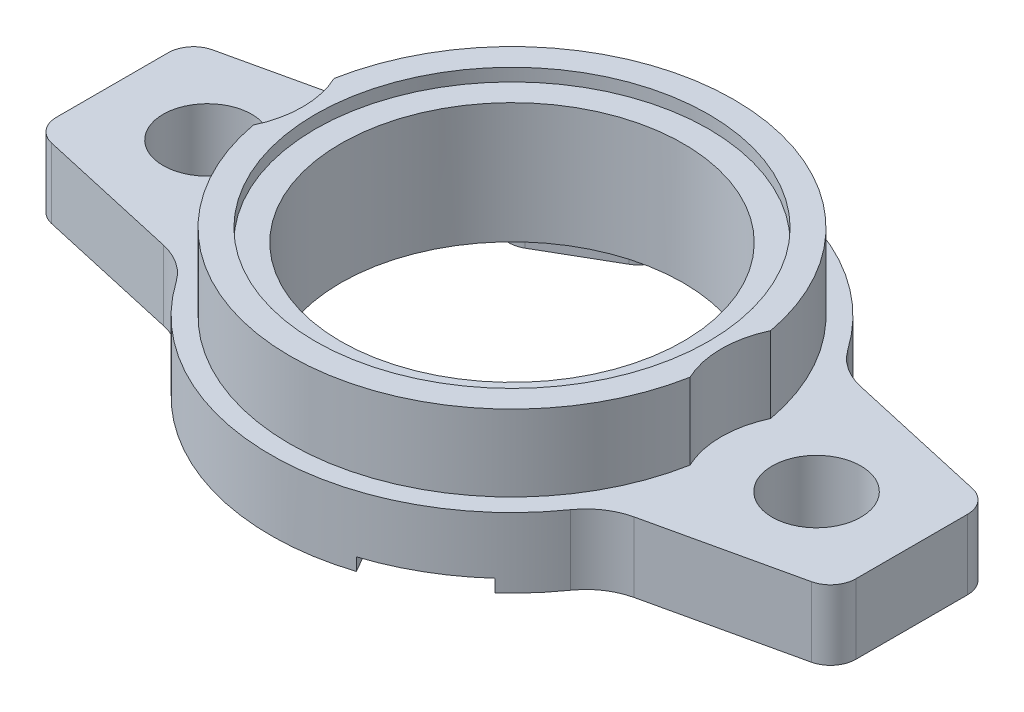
SolidWorks part; units mm, degrees
ref_plane "Спереди" through (0, 0, 0) normal (0, 0, 1) x (1, 0, 0)
ref_plane "Сверху" through (0, 0, 0) normal (0, 1, 0) x (1, 0, 0)
ref_plane "Справа" through (0, 0, 0) normal (1, 0, 0) x (0, 0, -1)
sketch "Эскиз1" plane through (0, 0, 0) normal (0, 1, 0) x (1, 0, 0)
  line L0 (-1000, 0) -> (49000, 0) construction
  line L1 (0, -1000) -> (0, 49000) construction
  line L2 (-31.5, 4.4) -> (-31.5, -4.4)
  line L3 (-29.939, 6.3512) -> (-16.5298, 9.3683)
  line L4 (-29.939, -6.3512) -> (-16.5298, -9.3683)
  line L5 (29.939, -6.3512) -> (16.5298, -9.3683)
  line L6 (29.939, 6.3512) -> (16.5298, 9.3683)
  line L7 (31.5, 4.4) -> (31.5, -4.4)
  circle A0 centre (0, 0) radius 19
  circle A1 centre (-24, 0) radius 3.5
  circle A2 centre (-24, 0) radius 7.5 construction
  arc A3 (-31.5, -4.4) -> (-29.939, -6.3512) centre (-29.5, -4.4) ccw
  arc A4 (-31.5, 4.4) -> (-29.939, 6.3512) centre (-29.5, 4.4) cw
  circle A5 centre (24, 0) radius 7.5 construction
  arc A6 (31.5, 4.4) -> (29.939, 6.3512) centre (29.5, 4.4) ccw
  arc A7 (31.5, -4.4) -> (29.939, -6.3512) centre (29.5, -4.4) cw
  circle A8 centre (24, 0) radius 3.5
  point P16 (-31.5, -6)
  point P19 (-31.5, 6)
  dimension "D1" = 38
  dimension "D3" = 7
  dimension "D4" = 15
  dimension "D6" = 2
  dimension "D2" = 48
  dimension "D5" = 12
extrude "Бобышка-Вытянуть1" add sketch "Эскиз1" along normal blind 11.5 contours A4 L2 A3 L4 A0 L3 A1 | A0 | A7 L7 A6 L6 A0 L5 A8
sketch "Эскиз2" plane through (0, 11.5, 0) normal (0, 1, 0) x (1, 0, 0)
  arc A0 (17.2083, 3.1817) -> (-17.2083, 3.1817) centre (0, 0) ccw
  arc A1 (16.5298, 9.3683) -> (-16.5298, 9.3683) centre (0, 0) ccw construction
  circle A2 centre (0, 0) radius 42.1139
  arc A3 (-17.2083, -3.1817) -> (-17.2083, 3.1817) centre (-24, 0) ccw
  arc A4 (17.2083, 3.1817) -> (17.2083, -3.1817) centre (24, 0) ccw
  arc A5 (-17.2083, -3.1817) -> (17.2083, -3.1817) centre (0, 0) ccw
  dimension "D1" = 1.5
extrude "Вырез-Вытянуть1" cut sketch "Эскиз2" against normal blind 6
sketch "Эскиз3" plane through (0, 11.5, 0) normal (0, 1, 0) x (1, 0, 0)
  circle A0 centre (0, 0) radius 15.5
  arc A1 (17.2083, 3.1817) -> (-17.2083, 3.1817) centre (0, 0) ccw construction
  dimension "D1" = 2
extrude "Вырез-Вытянуть3" cut sketch "Эскиз3" against normal blind 1
sketch "Эскиз4" plane through (0, 0, 0) normal (0, -1, 0) x (1, 0, 0)
  line L0 (-20.8486, -5.3216) -> (-15.7182, -6.4759)
  line L1 (-29.939, -6.3512) -> (-16.5298, -9.3683) construction
  line L2 (0, -1000) -> (0, 49000) construction
  line L3 (-1000, 0) -> (49000, 0) construction
  line L4 (-20.8486, 5.3216) -> (-15.7182, 6.4759)
  line L5 (20.8486, 5.3216) -> (15.7182, 6.4759)
  line L6 (20.8486, -5.3216) -> (15.7182, -6.4759)
  line L7 (0, 0) -> (25000, 43301.2702) construction
  line L9 (6.0359, 18.4545) -> (12.9641, 14.4545)
  line L10 (6.0359, 18.4545) -> (4.5359, 15.8564)
  line L11 (4.9019, 14.4904) -> (10.0981, 11.4904)
  line L12 (12.9641, 14.4545) -> (11.4641, 11.8564)
  line L13 (6.0359, 18.4545) -> (10.9641, 10.9904) construction
  line L14 (4.0359, 14.9904) -> (12.9641, 14.4545) construction
  line L15 (4.4019, 13.6244) -> (9.5981, 10.6244)
  line L18 (-0.2068, 0.1194) -> (-43301.477, 25000.1194) construction
  line L19 (5.6699, 19.8205) -> (3.6699, 16.3564) construction
  line L20 (5.6699, 19.8205) -> (14.3301, 14.8205) construction
  line L21 (14.3301, 14.8205) -> (12.3301, 11.3564) construction
  line L22 (-10.9641, -10.9904) -> (-6.0359, -18.4545) construction
  line L23 (-12.9641, -14.4545) -> (-4.0359, -14.9904) construction
  line L25 (-9.5981, -10.6244) -> (-4.4019, -13.6244)
  line L26 (-6.0359, -18.4545) -> (-4.5359, -15.8564)
  line L27 (-10.0981, -11.4904) -> (-4.9019, -14.4904)
  line L28 (-12.9641, -14.4545) -> (-11.4641, -11.8564)
  line L29 (-12.9641, -14.4545) -> (-6.0359, -18.4545)
  arc A0 (-15.7182, -6.4759) -> (-13.2561, -10.6432) centre (0, 0) ccw
  arc A1 (16.5298, 9.3683) -> (-16.5298, 9.3683) centre (0, 0) ccw construction
  arc A2 (-21.242, -3.5558) -> (-21.242, 3.5558) centre (-24, 0) ccw
  circle A3 centre (-24, 0) radius 3.5 construction
  arc A4 (21.242, 3.5558) -> (21.242, -3.5558) centre (24, 0) ccw
  arc A5 (10.0981, 11.4904) -> (11.4641, 11.8564) centre (10.5981, 12.3564) ccw
  arc A6 (20.8486, -5.3216) -> (21.242, -3.5558) centre (20.6291, -4.3459) ccw
  arc A7 (20.8486, 5.3216) -> (21.242, 3.5558) centre (20.6291, 4.3459) cw
  arc A8 (-20.8486, -5.3216) -> (-21.242, -3.5558) centre (-20.6291, -4.3459) cw
  arc A9 (-20.8486, 5.3216) -> (-21.242, 3.5558) centre (-20.6291, 4.3459) ccw
  arc A10 (15.7182, 6.4759) -> (13.2561, 10.6432) centre (0, 0) ccw
  arc A11 (4.5359, 15.8564) -> (4.9019, 14.4904) centre (5.4019, 15.3564) ccw
  arc A12 (3.4253, 15.661) -> (4.4019, 13.6244) centre (5.4019, 15.3564) ccw
  arc A13 (9.5981, 10.6244) -> (11.8502, 10.7969) centre (10.5981, 12.3564) ccw
  arc A14 (2.5892, 16.8017) -> (-15.7182, 6.4759) centre (0, 0) ccw
  arc A15 (-4.4019, -13.6244) -> (-3.4253, -15.661) centre (-5.4019, -15.3564) cw
  arc A16 (-11.8502, -10.7969) -> (-9.5981, -10.6244) centre (-10.5981, -12.3564) cw
  arc A17 (-11.4641, -11.8564) -> (-10.0981, -11.4904) centre (-10.5981, -12.3564) cw
  arc A18 (-4.9019, -14.4904) -> (-4.5359, -15.8564) centre (-5.4019, -15.3564) cw
  arc A19 (3.4253, 15.661) -> (2.5892, 16.8017) centre (2.4369, 15.8133) ccw
  arc A20 (-2.5892, -16.8017) -> (15.7182, -6.4759) centre (0, 0) ccw
  arc A21 (11.8502, 10.7969) -> (13.2561, 10.6432) centre (12.4763, 10.0171) cw
  arc A22 (3.6699, 16.3564) -> (4.4019, 13.6244) centre (5.4019, 15.3564) ccw construction
  arc A23 (-11.8502, -10.7969) -> (-13.2561, -10.6432) centre (-12.4763, -10.0171) cw
  arc A24 (9.5981, 10.6244) -> (12.3301, 11.3564) centre (10.5981, 12.3564) ccw construction
  arc A25 (-3.4253, -15.661) -> (-2.5892, -16.8017) centre (-2.4369, -15.8133) ccw
  point P1 (8.5, 14.7224)
  point P14 (24.9878, -4.3902)
  point P31 (24.9878, 4.3902)
  point P34 (-24.9878, -4.3902)
  point P37 (-24.9878, 4.3902)
  point P74 (-8.5, -14.7224)
  dimension "D1" = 2
  dimension "D2" = 1
  dimension "D3" = 1
  dimension "D7" = 1
  dimension "D9" = 2
  dimension "D4" = 30
  dimension "D5" = 4
  dimension "D6" = 8
  dimension "D8" = 1
extrude "Вырез-Вытянуть4" cut sketch "Эскиз4" against normal blind 1
fillet "Скругление1" radius 5 4 edges at (16.5298, 2.75, -9.3683) (-16.5298, 2.75, -9.3683) (-16.5298, 2.75, 9.3683) (16.5298, 2.75, 9.3683)
sketch "Эскиз5" plane through (0, 10.5, 0) normal (0, 1, 0) x (1, 0, 0)
  circle A0 centre (0, 0) radius 13.5
  circle A1 centre (0, 0) radius 15.5 construction
  dimension "D1" = 2
extrude "Вырез-Вытянуть6" cut sketch "Эскиз5" against normal blind 21
